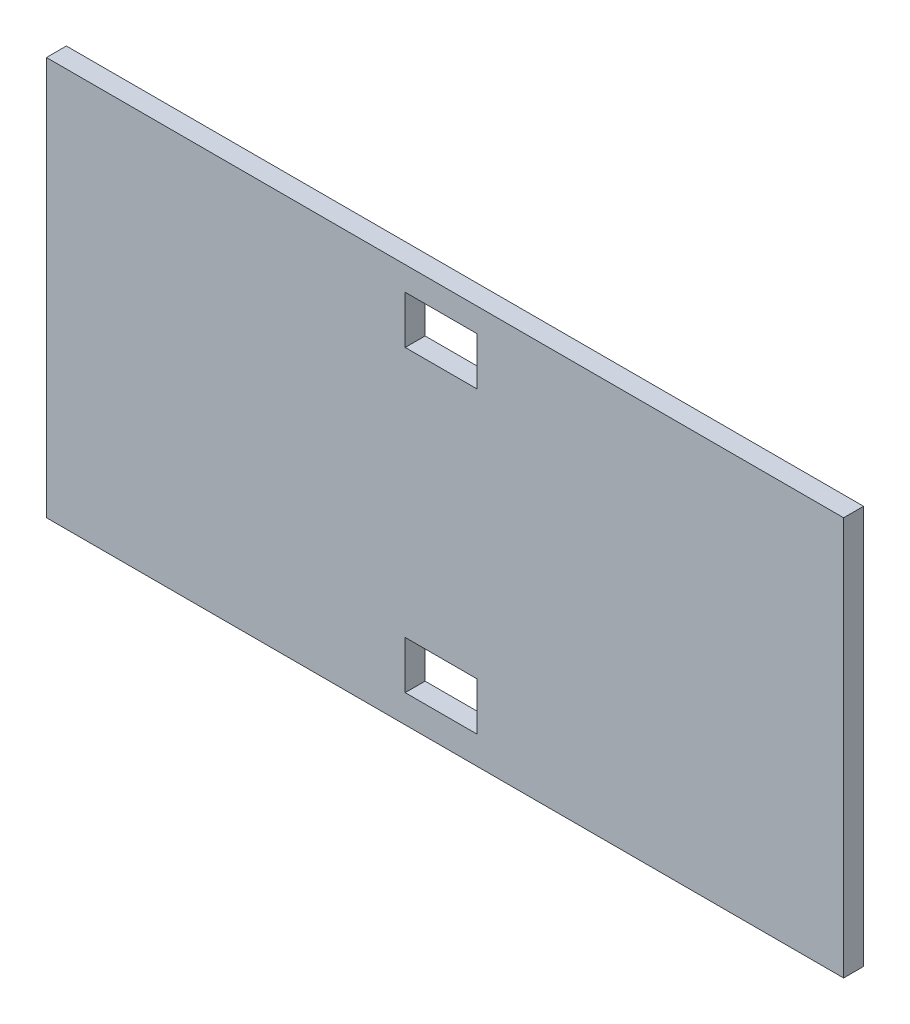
SolidWorks part; units mm, degrees
ref_plane "Front Plane" through (0, 0, 0) normal (0, 0, 1) x (1, 0, 0)
ref_plane "Top Plane" through (0, 0, 0) normal (0, 1, 0) x (1, 0, 0)
ref_plane "Right Plane" through (0, 0, 0) normal (1, 0, 0) x (0, 0, -1)
sketch "Sketch1" plane through (0, 0, 0) normal (0, 0, 1) x (1, 0, 0)
  line L1 (0, 0) -> (254, 0)
  line L2 (0, 0) -> (0, 127)
  line L3 (0, 127) -> (254, 127)
  line L4 (254, 0) -> (254, 127)
  dimension "D1" = 254
  dimension "D2" = 127
extrude "Boss-Extrude1" add sketch "Sketch1" along normal blind 6.35 contours L3 L4 L1 L2
sketch "Sketch2" plane through (0, 0, 6.35) normal (0, 0, 1) x (1, 0, 0)
  line L1 (114.3, 24.13) -> (137.16, 24.13)
  line L2 (114.3, 24.13) -> (114.3, 8.89)
  line L3 (114.3, 8.89) -> (137.16, 8.89)
  line L4 (137.16, 24.13) -> (137.16, 8.89)
  line L7 (0, 0) -> (0, 127) construction
  line L8 (0, 0) -> (254, 0) construction
  dimension "D1" = 8.89
  dimension "D2" = 114.3
  dimension "D3" = 15.24
  dimension "D4" = 22.86
extrude "Cut-Extrude1" cut sketch "Sketch2" against normal blind 6.35
pattern_linear "LPattern1" count 2 spacing 95.25 along (0, 1, 0) of "Cut-Extrude1"
